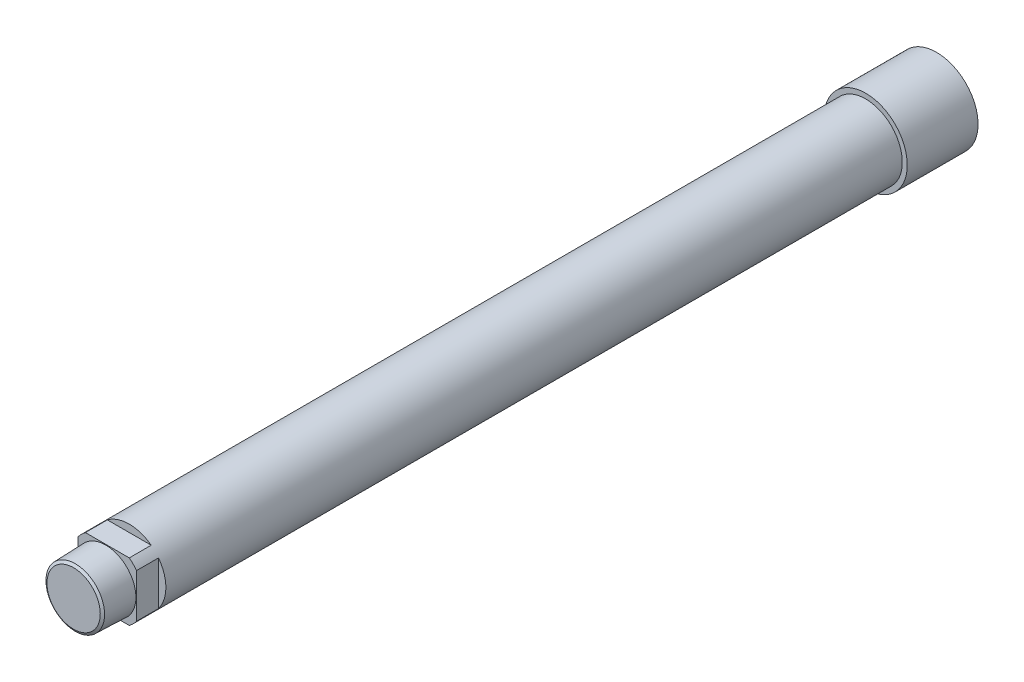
SolidWorks part; units mm, degrees
ref_plane "Front" through (0, 0, 0) normal (0, 0, 1) x (1, 0, 0)
ref_plane "Top" through (0, 0, 0) normal (0, 1, 0) x (1, 0, 0)
ref_plane "Right" through (0, 0, 0) normal (1, 0, 0) x (0, 0, -1)
sketch "Sketch1" plane through (0, 0, 0) normal (0, 0, 1) x (1, 0, 0)
  circle A0 centre (0, 0) radius 15.875
  circle A1 centre (0, 0) radius 9.525
  dimension "D1" = 31.75
  dimension "D2" = 19.05
extrude "Base-Extrude" add sketch "Sketch1" along normal blind 343.789
sketch "Sketch9" plane through (0, 0, 0) normal (1, 0, 0) x (0, 0, -1)
  line L0 (-342.8746, 8.9505) -> (-342.8746, 5.6909) construction
  line L1 (-343.789, 15.875) -> (-343.789, -15.875) construction
  line L2 (-343.789, 11.5697) -> (-342.8746, 13.0459)
  line L3 (-329.1586, 12.0244) -> (-329.1586, 15.875)
  line L4 (-343.789, 11.5697) -> (-343.789, 15.875)
  line L5 (-343.789, 15.875) -> (-329.1586, 15.875)
  line L6 (-343.789, 0) -> (-116.2585, 0) construction
  line L7 (0, 15.875) -> (-343.789, 15.875) construction
  line L8 (-343.789, 12.2936) -> (-196.9938, 16.8555) construction
  line L9 (-343.789, -12.5357) -> (-343.789, 11.5697) construction
  line L10 (-343.789, 11.5697) -> (-123.8402, 18.405) construction
  line L11 (-343.789, 13.0175) -> (-123.8402, 19.8528) construction
  line L13 (-342.8746, 13.0459) -> (-341.9602, 11.6265)
  line L14 (-341.9602, 11.6265) -> (-341.0458, 13.1028)
  line L15 (-341.0458, 13.1028) -> (-340.1314, 11.6834)
  line L16 (-340.1314, 11.6834) -> (-339.217, 13.1596)
  line L17 (-339.217, 13.1596) -> (-338.3026, 11.7402)
  line L18 (-338.3026, 11.7402) -> (-337.3882, 13.2164)
  line L19 (-337.3882, 13.2164) -> (-336.4738, 11.797)
  line L20 (-336.4738, 11.797) -> (-335.5594, 13.2733)
  line L21 (-335.5594, 13.2733) -> (-334.645, 11.8539)
  line L22 (-334.645, 11.8539) -> (-333.7306, 13.3301)
  line L23 (-333.7306, 13.3301) -> (-332.8162, 11.9107)
  line L24 (-332.8162, 11.9107) -> (-331.9018, 13.3869)
  line L25 (-331.9018, 13.3869) -> (-330.9874, 11.9675)
  line L26 (-330.9874, 11.9675) -> (-330.073, 13.4438)
  line L27 (-330.073, 13.4438) -> (-329.1586, 12.0244)
  dimension "D2" = 1.78
  dimension "D3" = 24.5872
  dimension "D4" = 23.1394
  dimension "D5" = 180
  dimension "D6" = 26.035
  dimension "D7" = 180
  dimension "D9" = 0.9144
  dimension "D11" = 1.8288
  dimension "D12" = 3.6576
  dimension "D13" = 5.4864
  dimension "D14" = 7.3152
  dimension "D15" = 9.144
  dimension "D16" = 10.9728
  dimension "D17" = 12.8016
  dimension "D18" = 14.6304
  dimension "D24" = 13.716
  dimension "D25" = 11.8872
  dimension "D26" = 10.0584
  dimension "D27" = 8.2296
  dimension "D28" = 6.4008
  dimension "D29" = 4.572
  dimension "D30" = 2.7432
revolve "Cut-Revolve1" cut sketch "Sketch9" angle 360 about L6
sketch "Sketch10" plane through (0, 0, 0) normal (1, 0, 0) x (0, 0, -1)
  line L0 (-343.789, 12.7) -> (-343.789, 15.875)
  line L1 (-329.1586, 15.875) -> (-329.1586, 13.1547)
  line L2 (0, 15.875) -> (-329.1586, 15.875) construction
  line L3 (-343.789, 0) -> (-90.4202, 0) construction
  line L4 (-343.789, 11.5697) -> (-343.789, -11.5697) construction
  line L5 (-329.1586, 13.1547) -> (-343.789, 12.7)
  line L6 (-343.789, 15.875) -> (-329.1586, 15.875)
  line L7 (-343.789, 11.5697) -> (-343.789, -11.5697) construction
  line L8 (-343.789, 0) -> (-119.8446, 0) construction
  line L12 (-329.1586, 15.875) -> (-329.1586, -15.875) construction
  dimension "D1" = 12.7
  dimension "D2" = 1.78
revolve "Cut-Revolve2" cut sketch "Sketch10" angle 360 about L8
sketch "Sketch11" plane through (0, 0, 329.1586) normal (0, 0, 1) x (1, 0, 0)
  line L1 (-12.7, -12.7) -> (12.7, -12.7)
  line L2 (-12.7, -12.7) -> (-12.7, 12.7)
  line L3 (-12.7, 12.7) -> (12.7, 12.7)
  line L4 (12.7, -12.7) -> (12.7, 12.7)
  circle A0 centre (0, 0) radius 25.4
  dimension "D5" = 50.8
  dimension "D1" = 25.4
  dimension "D2" = 25.4
  dimension "D3" = 12.7
  dimension "D4" = 12.7
extrude "Cut-Extrude5" cut sketch "Sketch11" against normal blind 9.525
ref_plane "Plane5" through (15.875, 0, 0) normal (1, 0, 0) x (0, 0, -1)
sketch "Sketch12" plane through (15.875, 0, 0) normal (1, 0, 0) x (0, 0, -1)
  line L0 (0, -15.875) -> (0, 15.875) construction
  circle A0 centre (-28.575, 0) radius 3.2766
  dimension "D1" = 6.5532
  dimension "D2" = 28.575
extrude "Cut-Extrude6" cut sketch "Sketch12" against normal blind 5.715
pattern_circular "CirPattern2" count 4 every 90 about axis through (0, 0, 0) along (0, 0, 1) of "Cut-Extrude6"
hole_wizard "15/16-16 Tapped Hole1" positions "Sketch14" profile "Sketch13" tap size "1-8" standard "Ansi Inch"
sketch "Sketch14" plane through (0, 0, 0) normal (0, 0, -1) x (-1, 0, 0)
  point P0 (0, 0)
sketch "Sketch13" plane through (0, 0, 0) normal (1, 0, 0) x (0, 1, 0)
  line L0 (0, 0) -> (0, 27.3146)
  line L1 (0, 27.3146) -> (11.1125, 20.6375)
  line L2 (11.1125, 20.6375) -> (11.1125, 0)
  line L5 (11.1125, 0) -> (0, 0)
  line L10 (0, 27.3146) -> (-11.1125, 20.6375) construction
  line L11 (0, -6.35) -> (0, 107.95) construction
  dimension "Tap Drill Dia." = 22.225
  dimension "Tap Drill Depth" = 20.6375
  dimension "Drill Angle" = 118
sketch "Sketch15" plane through (0, 0, 0) normal (1, 0, 0) x (0, 0, -1)
  line L0 (-343.789, 0) -> (-343.789, 11.5697)
  line L1 (-343.789, 11.5697) -> (-343.789, -11.5697) construction
  line L2 (-343.789, 11.5697) -> (-343.0751, 12.7222)
  line L3 (-343.0751, 12.7222) -> (-329.8725, 13.1325)
  line L4 (-329.8725, 13.1325) -> (-329.1586, 12.0244)
  line L5 (-329.1586, 12.0244) -> (-329.1586, 12.7)
  line L6 (-319.6336, 15.875) -> (0, 15.875)
  line L7 (0, -15.875) -> (0, 15.875) construction
  line L8 (0, 15.875) -> (-25.2984, 15.875) construction
  line L9 (0, 15.875) -> (0, 0)
  line L10 (0, 0) -> (-343.789, 0)
  line L12 (-343.0751, 12.7222) -> (-343.789, 11.5697) construction
  line L13 (-158.2659, 0) -> (16.1768, 0) construction
  line L14 (-329.1586, 12.7) -> (-319.6336, 12.7)
  line L15 (-319.6336, 12.7) -> (-319.6336, 15.875)
  line L16 (-319.6336, 15.875) -> (-319.6336, 12.7) construction
revolve "WEB Revolve1" add sketch "Sketch15" angle 360 about L13
sketch "Sketch16" plane through (0, 0, 0) normal (0, 0, -1) x (-1, 0, 0)
  circle A0 centre (0, 0) radius 18.034
  dimension "D1" = 36.068
extrude "WEB Extrude1" add sketch "Sketch16" along normal blind 30.734
sketch "Sketch17" plane through (0, 0, -30.734) normal (0, 0, -1) x (-1, 0, 0)
  circle A0 centre (0, 0) radius 7.9375
  dimension "D1" = 15.875
extrude "WEB CUT Extrude1" cut sketch "Sketch17" against normal offset from surface (230.759 mm away) 143.764
